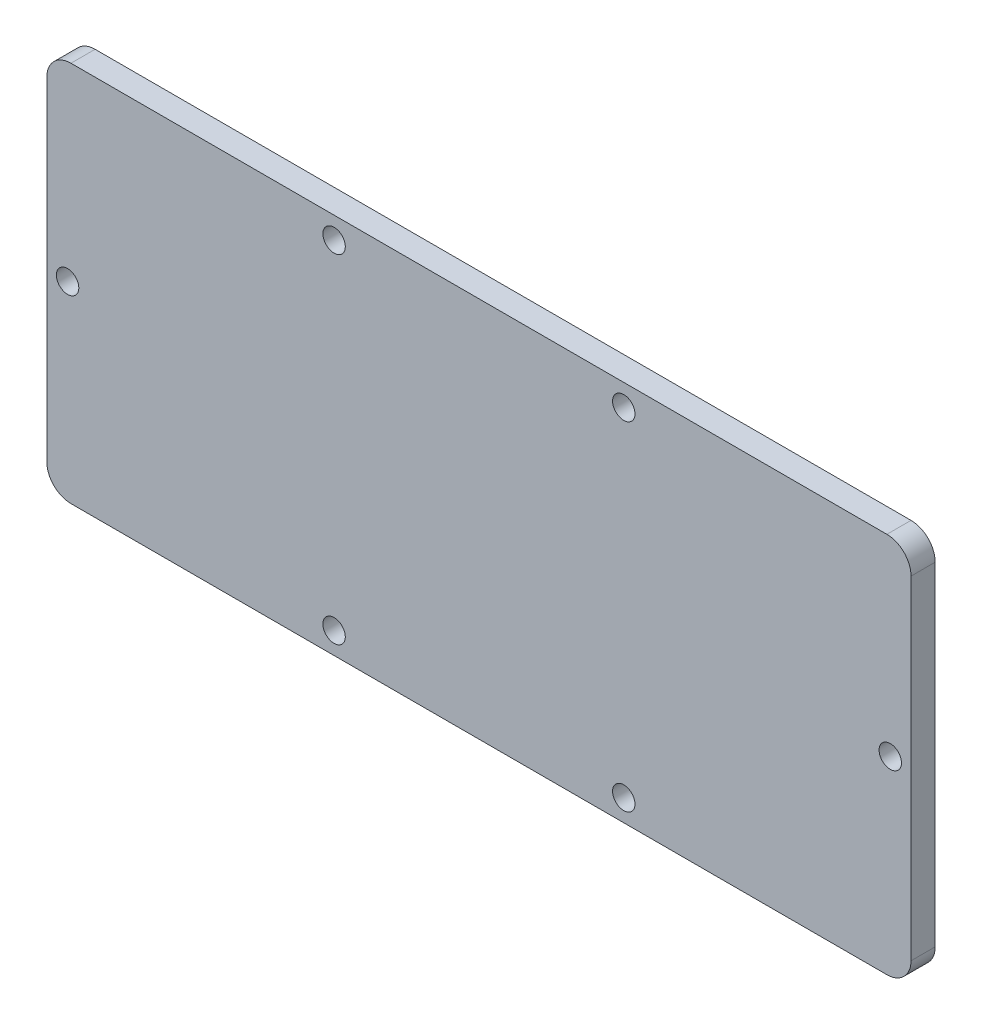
SolidWorks part; units mm, degrees
ref_plane "Front Plane" through (0, 0, 0) normal (0, 0, 1) x (1, 0, 0)
ref_plane "Top Plane" through (0, 0, 0) normal (0, 1, 0) x (1, 0, 0)
ref_plane "Right Plane" through (0, 0, 0) normal (1, 0, 0) x (0, 0, -1)
sketch "Sketch1" plane through (0, 0, 0) normal (0, 0, 1) x (1, 0, 0)
  line L1 (-53.6575, 25.0825) -> (53.6575, 25.0825)
  line L2 (-56.8325, 21.9075) -> (-56.8325, -21.9075)
  line L3 (-53.6575, -25.0825) -> (53.6575, -25.0825)
  line L4 (56.8325, 21.9075) -> (56.8325, -21.9075)
  line L5 (-56.8325, 25.0825) -> (56.8325, -25.0825) construction
  line L6 (-56.8325, -25.0825) -> (56.8325, 25.0825) construction
  arc A0 (53.6575, -25.0825) -> (56.8325, -21.9075) centre (53.6575, -21.9075) ccw
  arc A1 (56.8325, 21.9075) -> (53.6575, 25.0825) centre (53.6575, 21.9075) ccw
  arc A2 (-53.6575, -25.0825) -> (-56.8325, -21.9075) centre (-53.6575, -21.9075) cw
  arc A3 (-53.6575, 25.0825) -> (-56.8325, 21.9075) centre (-53.6575, 21.9075) ccw
  point P0 (0, 0)
  dimension "D3" = 3.175
  dimension "D1" = 113.665
  dimension "D2" = 50.165
extrude "Boss-Extrude1" add sketch "Sketch1" along normal blind 3.175
sketch "Sketch2" plane through (0, 0, 0) normal (0, 0, -1) x (-1, 0, 0)
  circle A0 centre (19.05, 22.225) radius 1.4732
  circle A1 centre (54.102, 0) radius 1.4732
  circle A2 centre (19.05, -22.225) radius 1.4732
  circle A3 centre (-19.05, 22.225) radius 1.4732
  circle A4 centre (-19.05, -22.225) radius 1.4732
  circle A5 centre (-54.102, 0) radius 1.4732
  dimension "D1" = 2.9464
  dimension "D2" = 2.9464
  dimension "D3" = 2.9464
  dimension "D4" = 2.9464
  dimension "D5" = 2.9464
  dimension "D6" = 2.9464
extrude "Cut-Extrude1" cut sketch "Sketch2" against normal through all
